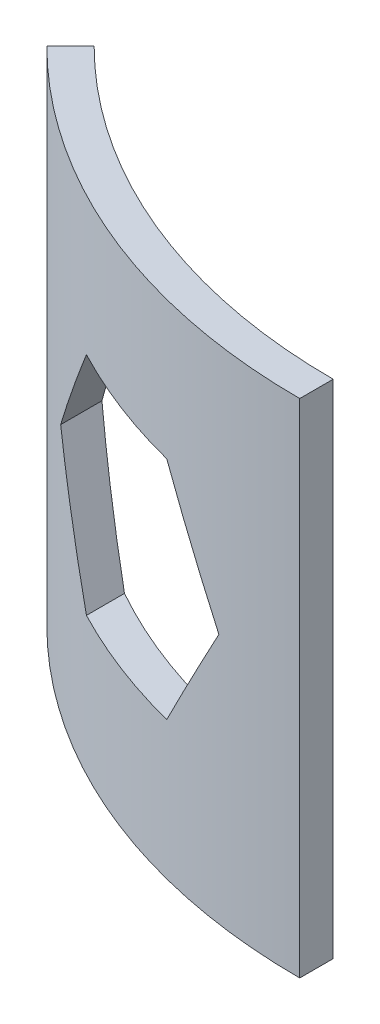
SolidWorks part; units mm, degrees
ref_plane "Front Plane" through (0, 0, 0) normal (0, 0, 1) x (1, 0, 0)
ref_plane "Top Plane" through (0, 0, 0) normal (0, 1, 0) x (1, 0, 0)
ref_plane "Right Plane" through (0, 0, 0) normal (1, 0, 0) x (0, 0, -1)
sketch "Sketch1" plane through (0, 0, 0) normal (0, 1, 0) x (1, 0, 0)
  line L0 (0, 0) -> (0, -3650)
  line L1 (0, 0) -> (-2580.9398, -2580.9398)
  arc A0 (-2580.9398, -2580.9398) -> (0, -3650) centre (0, 0) ccw
  arc A1 (-2439.5184, -2439.5184) -> (0, -3450) centre (0, 0) ccw
  dimension "D1" = 7300
  dimension "D2" = 200
  dimension "D3" = 45
extrude "Boss-Extrude1" add sketch "Sketch1" along normal blind 3000 contours A1 L1 A0 L0
ref_plane "Plane2" through (0, 0, 3650) normal (0, 0, 1) x (1, 0, 0)
sketch "Sketch4" plane through (0, 0, 3650) normal (0, 0, 1) x (1, 0, 0)
  line L1 (-2079.4229, 1500) -> (-1689.7114, 825)
  line L2 (-1689.7114, 825) -> (-910.2886, 825)
  line L3 (-910.2886, 825) -> (-520.5771, 1500)
  line L4 (-520.5771, 1500) -> (-910.2886, 2175)
  line L5 (-910.2886, 2175) -> (-1689.7114, 2175)
  line L6 (-1689.7114, 2175) -> (-2079.4229, 1500)
  circle A0 centre (-1300, 1500) radius 675 construction
  dimension "D3" = 1350
  dimension "D1" = 1500
  dimension "D2" = 1300
extrude "Cut-Extrude2" cut sketch "Sketch4" against normal through all from surface
